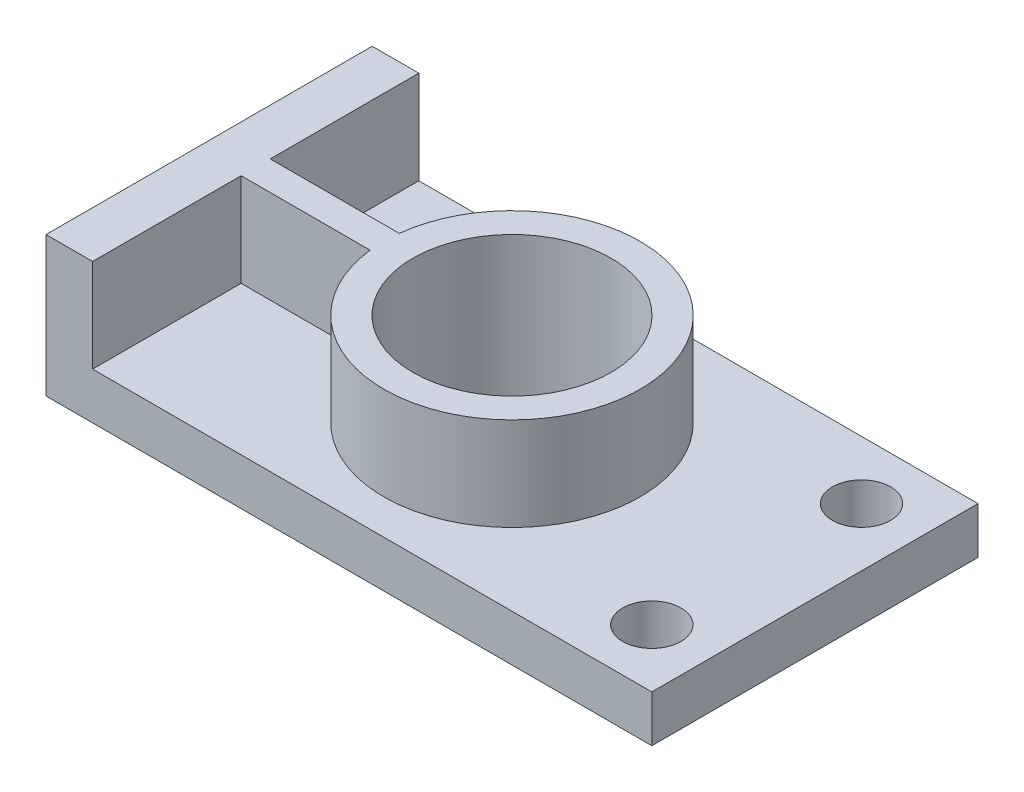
SolidWorks part; units mm, degrees
ref_plane "Plane1" through (0, 0, 0) normal (0, 0, 1) x (1, 0, 0)
ref_plane "Plane2" through (0, 0, 0) normal (0, 1, 0) x (1, 0, 0)
ref_plane "Plane3" through (0, 0, 0) normal (1, 0, 0) x (0, 0, -1)
sketch "Sketch1" plane through (0, 0, 0) normal (0, 0, 1) x (1, 0, 0)
  line L0 (0, 38.1) -> (0, 0)
  line L1 (0, 0) -> (165.1, 0)
  dimension "D1" = 165.1
  dimension "D2" = 38.1
extrude "Base-Extrude-Thin" add sketch "Sketch1" against normal blind 88.9 thin
sketch "Sketch2" plane through (0, 38.1, 0) normal (0, 1, 0) x (-1, 0, 0)
  line L0 (0, -88.9) -> (-165.1, 0) construction
  circle A0 centre (-82.55, -44.45) radius 34.925
  dimension "D1" = 69.85
extrude "Boss-Extrude1" add sketch "Sketch2" against normal up to next
sketch "Sketch3" plane through (0, 38.1, 0) normal (0, 1, 0) x (-1, 0, 0)
  circle A0 centre (-82.55, -44.45) radius 26.9875
  dimension "D1" = 53.975
extrude "Cut-Extrude1" cut sketch "Sketch3" against normal through all
sketch "Sketch4" plane through (0, 12.7, 0) normal (0, 1, 0) x (-1, 0, 0)
  line L0 (-12.7, 0) -> (-165.1, 0) construction
  line L1 (-165.1, -88.9) -> (-165.1, 0) construction
  line L2 (-12.7, -88.9) -> (-165.1, -88.9) construction
  circle A0 centre (-149.225, -15.875) radius 7.9375
  circle A1 centre (-149.225, -73.025) radius 7.9375
  dimension "D1" = 15.875
  dimension "D2" = 15.875
  dimension "D3" = 15.875
  dimension "D4" = 15.875
extrude "Cut-Extrude2" cut sketch "Sketch4" against normal through all
ref_plane "Rib Plane" through (0, 38.1, 0) normal (0, 1, 0) x (-1, 0, 0)
sketch "Sketch5" plane through (0, 38.1, 0) normal (0, 1, 0) x (-1, 0, 0)
  line L0 (-42.7788, -44.45) -> (-21.6504, -44.45)
rib "Rib1" sketch "Sketch5" sketch "Sketch5" thickness 7.9375 extrusion direction normal to sketch draft on no parameters "D1"=7.9375
